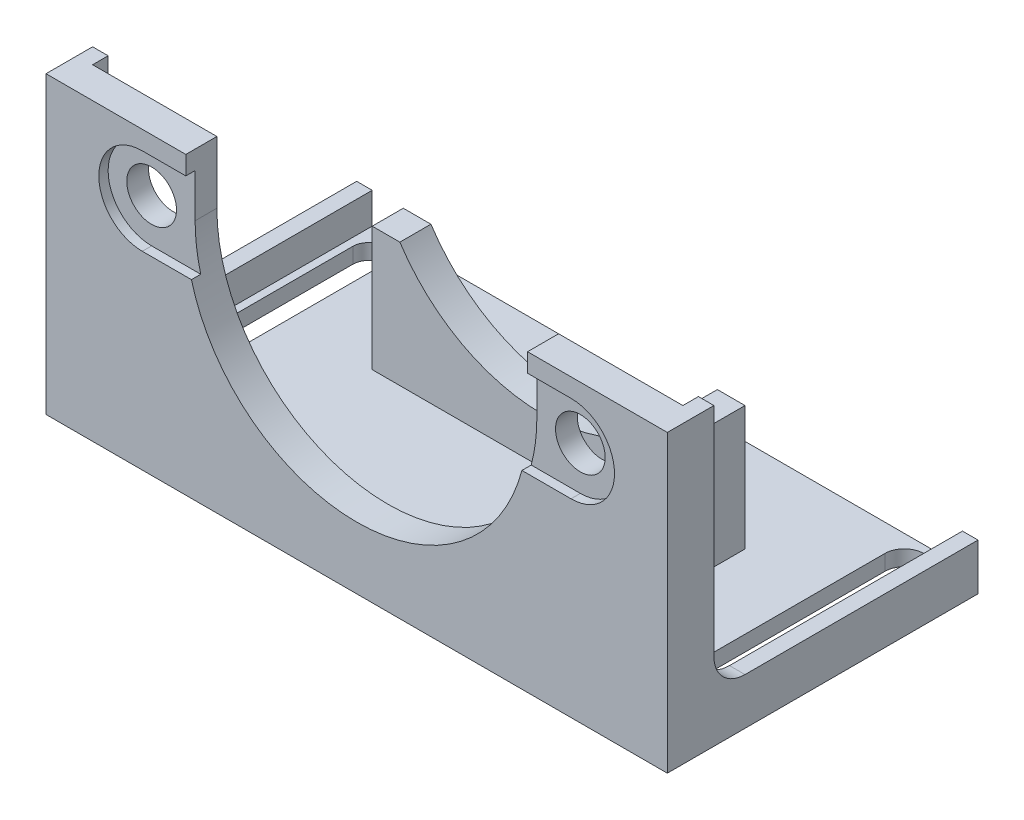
SolidWorks part; units mm, degrees
ref_plane "Front Plane" through (0, 0, 0) normal (0, 0, 1) x (1, 0, 0)
ref_plane "Top Plane" through (0, 0, 0) normal (0, 1, 0) x (1, 0, 0)
ref_plane "Right Plane" through (0, 0, 0) normal (1, 0, 0) x (0, 0, -1)
sketch "Sketch1" plane through (0, 0, 0) normal (0, 0, 1) x (1, 0, 0)
  line L1 (0, 0) -> (50.8, 0)
  line L2 (0, 0) -> (0, 24.13)
  line L3 (0, 24.13) -> (50.8, 24.13)
  line L4 (50.8, 0) -> (50.8, 24.13)
  dimension "D1" = 50.8
  dimension "D2" = 24.13
extrude "Boss-Extrude1" add sketch "Sketch1" along normal blind 25.4
sketch "Sketch2" plane through (0, 0, 25.4) normal (0, 0, 1) x (1, 0, 0)
  line L0 (25.4, -2.4846) -> (25.4, 28.3149) construction
  line L1 (42.926, 19.05) -> (7.874, 19.05) construction
  line L2 (50.8, 24.13) -> (0, 24.13) construction
  line L3 (11.43, 19.05) -> (11.43, 33.02)
  line L4 (39.37, 19.05) -> (39.37, 33.02)
  line L5 (39.37, 33.02) -> (11.43, 33.02)
  circle A0 centre (7.874, 19.05) radius 2.032
  circle A1 centre (42.926, 19.05) radius 2.032
  arc A2 (11.43, 19.05) -> (39.37, 19.05) centre (25.4, 19.05) ccw
  point P5 (25.4, 19.05)
  dimension "D3" = 4.064
  dimension "D4" = 4.064
  dimension "D5" = 27.94
  dimension "D1" = 35.052
  dimension "D2" = 5.08
extrude "Cut-Extrude1" cut sketch "Sketch2" against normal through all
sketch "Sketch3" plane through (0, 24.13, 0) normal (0, 1, 0) x (1, 0, 0)
  line L0 (50.8, -25.4) -> (39.37, -25.4) construction
  line L1 (1.27, 1.6377) -> (49.53, 1.6377)
  line L2 (1.27, 1.6377) -> (1.27, -22.86)
  line L3 (1.27, -22.86) -> (49.53, -22.86)
  line L4 (49.53, 1.6377) -> (49.53, -22.86)
  line L5 (0, -25.4) -> (0, 0) construction
  line L6 (50.8, -25.4) -> (50.8, 0) construction
  dimension "D1" = 2.54
  dimension "D2" = 1.27
  dimension "D3" = 1.27
extrude "Cut-Extrude2" cut sketch "Sketch3" against normal offset from surface (22.86 mm away) 1.27
sketch "Sketch5" plane through (0, 0, 25.4) normal (0, 0, 1) x (1, 0, 0)
  line L0 (7.874, 19.05) -> (42.926, 19.05) construction
  line L1 (7.874, 22.606) -> (42.926, 22.606)
  line L2 (7.874, 15.494) -> (42.926, 15.494)
  arc A0 (7.874, 22.606) -> (7.874, 15.494) centre (7.874, 19.05) ccw
  arc A1 (42.926, 15.494) -> (42.926, 22.606) centre (42.926, 19.05) ccw
  point P4 (25.4, 19.05)
  dimension "D1" = 7.112
extrude "Cut-Extrude5" cut sketch "Sketch5" against normal blind 0.762
sketch "Sketch6" plane through (0, 1.27, 0) normal (0, 1, 0) x (1, 0, 0)
  line L0 (11.43, -25.4) -> (11.43, -7.62) construction
  line L1 (39.37, -25.4) -> (39.37, -7.62) construction
  line L2 (39.37, -7.62) -> (11.43, -7.62) construction
  line L3 (49.53, -22.86) -> (1.27, -22.86) construction
  line L4 (11.43, -7.62) -> (39.37, -7.62)
  line L5 (11.43, -7.62) -> (11.43, -10.16)
  line L6 (11.43, -10.16) -> (39.37, -10.16)
  line L7 (39.37, -7.62) -> (39.37, -10.16)
  dimension "D1" = 2.54
  dimension "D2" = 12.7
extrude "Boss-Extrude3" add sketch "Sketch6" along normal blind 10.16
sketch "Sketch7" plane through (0, 0, 10.16) normal (0, 0, 1) x (1, 0, 0)
  line L0 (7.874, 19.05) -> (42.926, 19.05) construction
  line L1 (11.43, 19.05) -> (11.43, 24.13)
  line L2 (11.43, 24.13) -> (39.37, 24.13)
  line L3 (39.37, 24.13) -> (39.37, 19.05)
  arc A0 (11.43, 19.05) -> (39.37, 19.05) centre (25.4, 19.05) ccw
extrude "Cut-Extrude6" cut sketch "Sketch7" against normal through all
sketch "Sketch11" plane through (0, 0, 0) normal (-1, 0, 0) x (0, 0, 1)
  line L0 (25.4, 24.13) -> (25.4, 0) construction
  line L1 (21.59, 40.5957) -> (-8.8332, 40.5957)
  line L2 (21.59, 40.5957) -> (21.59, 3.81)
  line L3 (21.59, 3.81) -> (-8.8332, 3.81)
  line L4 (-8.8332, 40.5957) -> (-8.8332, 3.81)
  line L5 (25.4, 0) -> (0, 0) construction
  dimension "D1" = 3.81
  dimension "D2" = 3.81
extrude "Cut-Extrude8" cut sketch "Sketch11" against normal blind 2.54
sketch "Sketch12" plane through (50.8, 0, 0) normal (1, 0, 0) x (0, 0, -1)
  line L0 (-25.4, 0) -> (-25.4, 24.13) construction
  line L1 (-21.59, 32.8673) -> (6.1733, 32.8673)
  line L2 (-21.59, 32.8673) -> (-21.59, 3.81)
  line L3 (-21.59, 3.81) -> (6.1733, 3.81)
  line L4 (6.1733, 32.8673) -> (6.1733, 3.81)
  line L5 (-25.4, 0) -> (0, 0) construction
  dimension "D1" = 3.81
  dimension "D2" = 3.81
extrude "Cut-Extrude9" cut sketch "Sketch12" against normal blind 2.54
fillet "Fillet1" radius 2.54 2 edges at (0.635, 3.81, 21.59) (50.165, 3.81, 21.59)
sketch "Sketch14" plane through (0, 1.27, 0) normal (0, 1, 0) x (1, 0, 0)
  line L0 (3.175, -2.2156) -> (3.175, -19.9956) construction
  line L1 (4.445, -2.2156) -> (4.445, -19.9956)
  line L2 (1.905, -2.2156) -> (1.905, -19.9956)
  line L3 (46.99, -2.2156) -> (46.99, -19.9956) construction
  line L4 (48.5775, -2.2156) -> (48.5775, -19.9956)
  line L5 (45.4025, -2.2156) -> (45.4025, -19.9956)
  line L7 (49.53, -19.05) -> (49.53, 0) construction
  line L8 (0, 0) -> (0, -19.05) construction
  arc A0 (4.445, -2.2156) -> (1.905, -2.2156) centre (3.175, -2.2156) ccw
  arc A1 (1.905, -19.9956) -> (4.445, -19.9956) centre (3.175, -19.9956) ccw
  arc A2 (48.5775, -2.2156) -> (45.4025, -2.2156) centre (46.99, -2.2156) ccw
  arc A3 (45.4025, -19.9956) -> (48.5775, -19.9956) centre (46.99, -19.9956) ccw
  point P2 (3.175, -11.1056)
  point P7 (46.99, -11.1056)
  dimension "D1" = 1.27
  dimension "D2" = 1.5875
  dimension "D3" = 3.175
  dimension "D4" = 2.54
  dimension "D5" = 17.78
  dimension "D6" = 17.78
extrude "Cut-Extrude10" cut sketch "Sketch14" against normal through all
